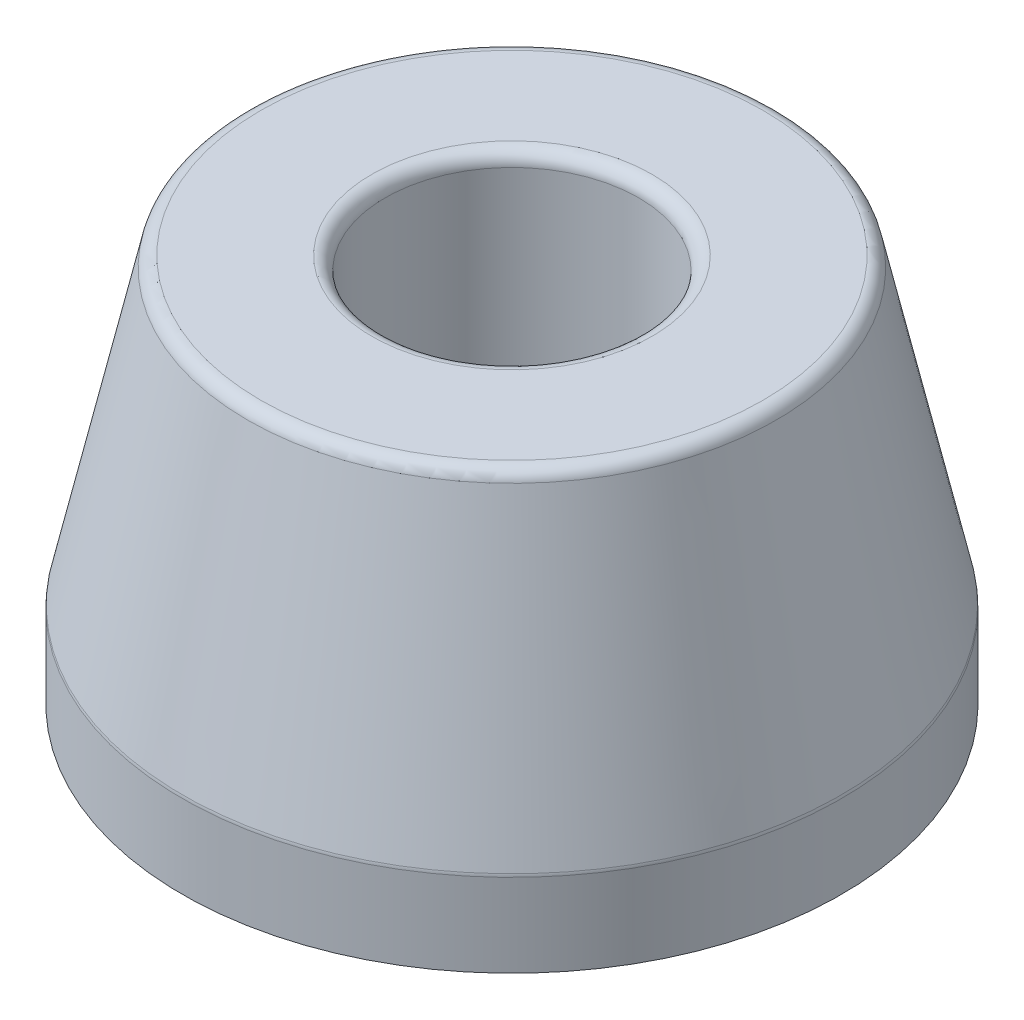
SolidWorks part; units mm, degrees
ref_plane "Front" through (0, 0, 0) normal (0, 0, 1) x (1, 0, 0)
ref_plane "Top" through (0, 0, 0) normal (0, 1, 0) x (1, 0, 0)
ref_plane "Right" through (0, 0, 0) normal (1, 0, 0) x (0, 0, -1)
sketch "Sketch1" plane through (0, 0, 0) normal (0, 0, 1) x (1, 0, 0)
  line L0 (4.7625, 0) -> (4.7625, 14.097)
  line L1 (5.2705, 14.605) -> (9.435, 14.605)
  line L2 (9.9309, 14.2072) -> (12.3704, 3.2294)
  line L3 (12.3825, 3.1192) -> (12.3825, 0)
  line L4 (12.3825, 0) -> (4.7625, 0)
  line L5 (0, 0) -> (0, 14.605) construction
  arc A0 (12.3704, 3.2294) -> (12.3825, 3.1192) centre (11.8745, 3.1192) cw
  arc A1 (4.7625, 14.097) -> (5.2705, 14.605) centre (5.2705, 14.097) cw
  arc A2 (9.435, 14.605) -> (9.9309, 14.2072) centre (9.435, 14.097) cw
  point P8 (12.3825, 3.175)
  point P11 (4.7625, 14.605)
  point P14 (9.8425, 14.605)
  dimension "D6" = 0.508
  dimension "D1" = 14.605
  dimension "D2" = 4.7625
  dimension "D3" = 5.08
  dimension "D4" = 3.175
  dimension "D5" = 7.62
revolve "Revolve1" add sketch "Sketch1" angle 360 about L5
